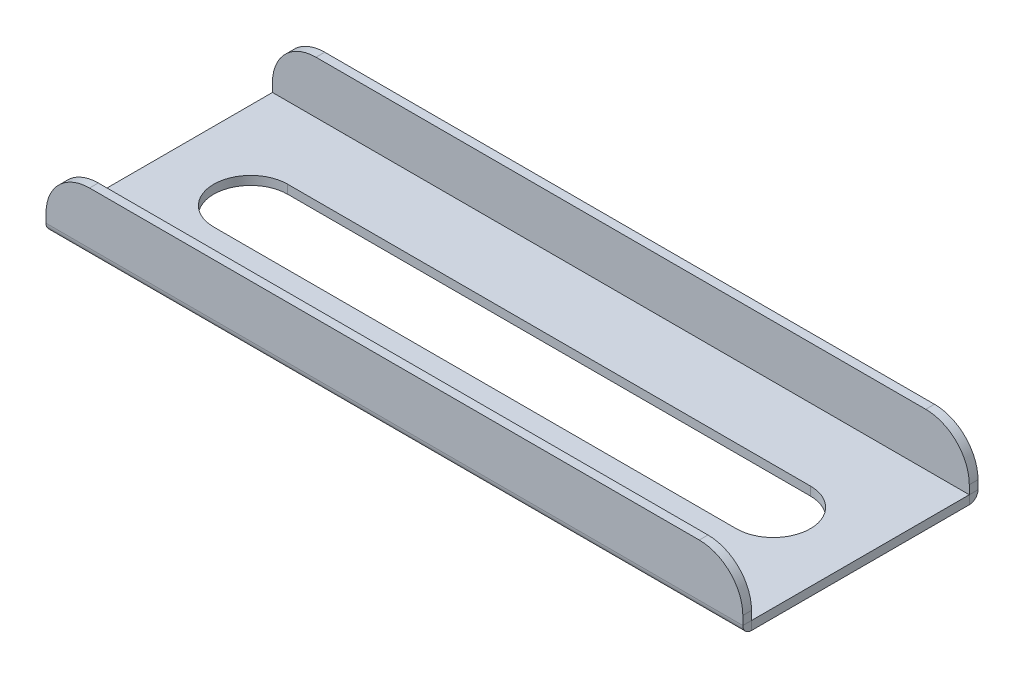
SolidWorks part; units mm, degrees
ref_plane "Front Plane" through (0, 0, 0) normal (0, 0, 1) x (1, 0, 0)
ref_plane "Top Plane" through (0, 0, 0) normal (0, 1, 0) x (1, 0, 0)
ref_plane "Right Plane" through (0, 0, 0) normal (1, 0, 0) x (0, 0, -1)
sketch "Sketch1" plane through (0, 0, 0) normal (0, 1, 0) x (1, 0, 0)
  line L0 (0, 18.5) -> (80, 18.5) construction
  line L1 (5, 0) -> (75, 0)
  line L2 (0, 5) -> (0, 32)
  line L3 (5, 37) -> (75, 37)
  line L4 (80, 5) -> (80, 32)
  line L5 (70, 22.75) -> (10, 22.75)
  line L6 (10, 14.25) -> (70, 14.25)
  arc A0 (10, 22.75) -> (10, 14.25) centre (10, 18.5) ccw
  arc A1 (70, 14.25) -> (70, 22.75) centre (70, 18.5) ccw
  arc A2 (80, 32) -> (75, 37) centre (75, 32) ccw
  arc A3 (75, 0) -> (80, 5) centre (75, 5) ccw
  arc A4 (0, 5) -> (5, 0) centre (5, 5) ccw
  arc A5 (0, 32) -> (5, 37) centre (5, 32) cw
  point P15 (80, 37)
  point P18 (80, 0)
  point P21 (0, 0)
  dimension "D3" = 4.25
  dimension "D4" = 10
  dimension "D5" = 10
  dimension "D6" = 5
  dimension "D1" = 80
  dimension "D2" = 37
sheet metal parameters "Sheet-Metal1" thickness 1 parameters "D1"=0.0001
base flange "Base-Flange1" sketch "Sketch1" thickness 1 reverse thickness direction yes parameters "D1"=0.0001
sketch "Sketch3" plane through (0, 1, 0) normal (0, 1, 0) x (1, 0, 0)
  line L0 (0, 31) -> (80, 31)
  line L1 (0, 32) -> (0, 5) construction
  line L2 (80, 5) -> (80, 32) construction
  line L3 (0, 6) -> (80, 6)
  line L4 (75, 37) -> (5, 37) construction
  line L5 (5, 0) -> (75, 0) construction
  dimension "D1" = 6
  dimension "D2" = 6
sketched bend "Sketched Bend1" parameters "D1"=0
bend "SketchBend1" bend radius 0.0001 bend angle 90 parameters "D5"=1
bend "SketchBend2" bend radius 0 bend angle 90 parameters "D5"=2
flat pattern "Flat-Pattern1"
sketch "Bend-Lines1" plane through (0, 0, 0) normal (0, 1, 0) x (-1, 0, 0)
bend of the flat pattern "Flatten-<SketchBend1>1"
bend of the flat pattern "Flatten-<SketchBend2>1"
